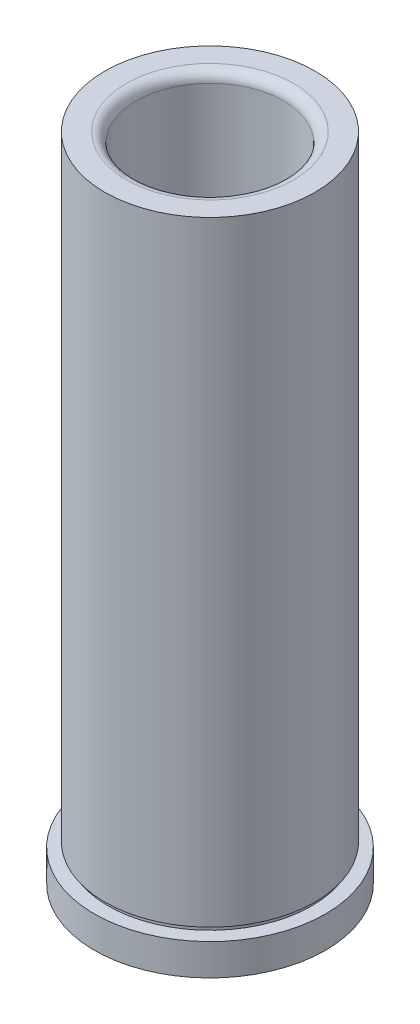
SolidWorks part; units mm, degrees
ref_plane "Front Plane" through (0, 0, 0) normal (0, 0, 1) x (1, 0, 0)
ref_plane "Top Plane" through (0, 0, 0) normal (0, 1, 0) x (1, 0, 0)
ref_plane "Right Plane" through (0, 0, 0) normal (1, 0, 0) x (0, 0, -1)
sketch "Sketch1" plane through (0, 0, 0) normal (0, 0, 1) x (1, 0, 0)
  line L0 (-736.3938, 0) -> (49263.6062, 0) construction
  line L1 (0, -1000) -> (0, 49000) construction
  line L2 (-11.1189, 98.425) -> (-11.1188, 53.975)
  line L4 (-17.4625, 0) -> (-17.4625, 4.7625)
  line L5 (-17.4625, 4.7625) -> (-15.3733, 4.7625)
  line L6 (-15.8814, 98.425) -> (-15.8813, 5.5245)
  line L7 (-15.8814, 98.425) -> (-11.1189, 98.425)
  line L9 (-12.3888, 52.705) -> (-12.3888, 0.7938)
  line L10 (-15.8813, 5.5245) -> (-15.3733, 5.5245)
  line L11 (-15.3733, 5.5245) -> (-15.3733, 4.7625)
  line L12 (-12.3888, 0.7938) -> (-13.1826, 0)
  line L14 (-13.1826, 0) -> (-17.4625, 0)
  arc A0 (-11.1188, 53.975) -> (-12.3888, 52.705) centre (-11.1188, 52.705) ccw
  dimension "D1" = 0.508
  dimension "OD" = 31.7627
  dimension "ID" = 22.2377
  dimension "FLANGETHICKNESS" = 4.7625
  dimension "FLANGEDIA" = 34.925
  dimension "D2" = 44.45
  dimension "D3" = 0.762
  dimension "D4" = 1.27
  dimension "D5" = 45
  dimension "D6" = 0.7937
  dimension "D7" = 98.425
revolve "Revolve1" add sketch "Sketch1" angle 360 about L1
fillet "Fillet1" radius 1.524 1 edges at (11.1188, 98.425, 0)
